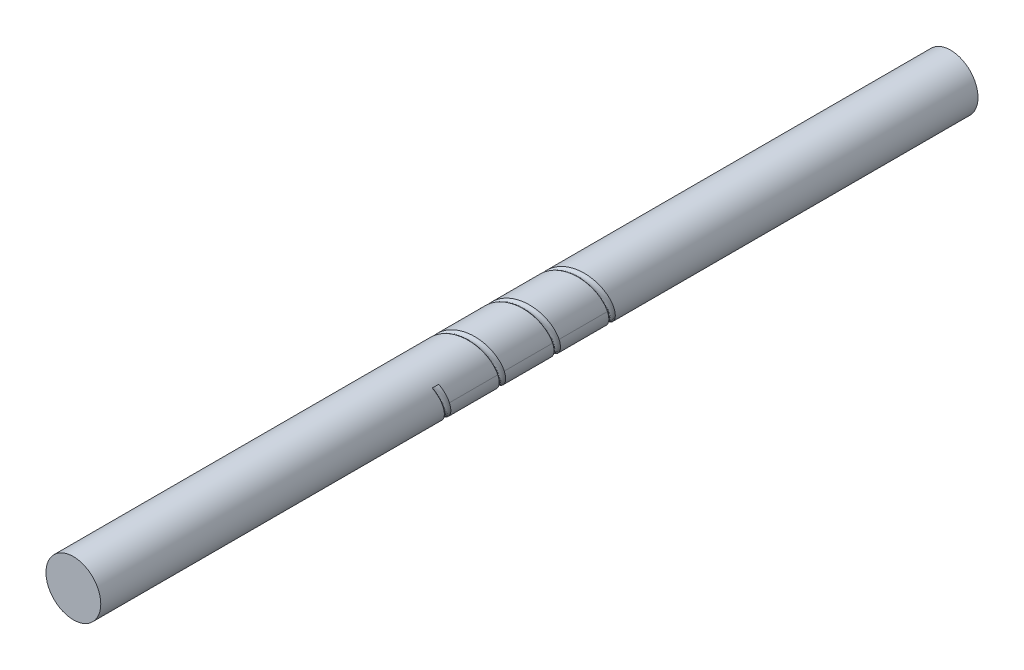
SolidWorks part; units mm, degrees
ref_plane "Front Plane" through (0, 0, 0) normal (0, 0, 1) x (1, 0, 0)
ref_plane "Top Plane" through (0, 0, 0) normal (0, 1, 0) x (1, 0, 0)
ref_plane "Right Plane" through (0, 0, 0) normal (1, 0, 0) x (0, 0, -1)
sketch "Sketch1" plane through (0, 0, 0) normal (0, 0, 1) x (1, 0, 0)
  circle A0 centre (0, 0) radius 25
  dimension "D1" = 50
extrude "Boss-Extrude1" add sketch "Sketch1" along normal blind 800
ref_plane "Plane1" through (0, 0, 310) normal (0, 0, 1) x (1, 0, 0)
sketch "Sketch2" plane through (0, 0, 310) normal (0, 0, 1) x (1, 0, 0)
  circle A0 centre (0, 0) radius 27.646
  dimension "D1" = 55.292
curve "Helix/Spiral1"
sketch "Sketch3" plane through (0, 0, 0) normal (0, 1, 0) x (1, 0, 0)
  circle A0 centre (-27.646, -310) radius 3.969
  spline S0 degree 3 number of poles 88 (-27.646, -310) -> (22.3661, -490) construction
  dimension "D1" = 7.938
sweep "Cut-Sweep1" cut profiles "Sketch3" path "Helix/Spiral1"
pattern_linear "LPattern1" [suppressed] count 2 spacing 500
